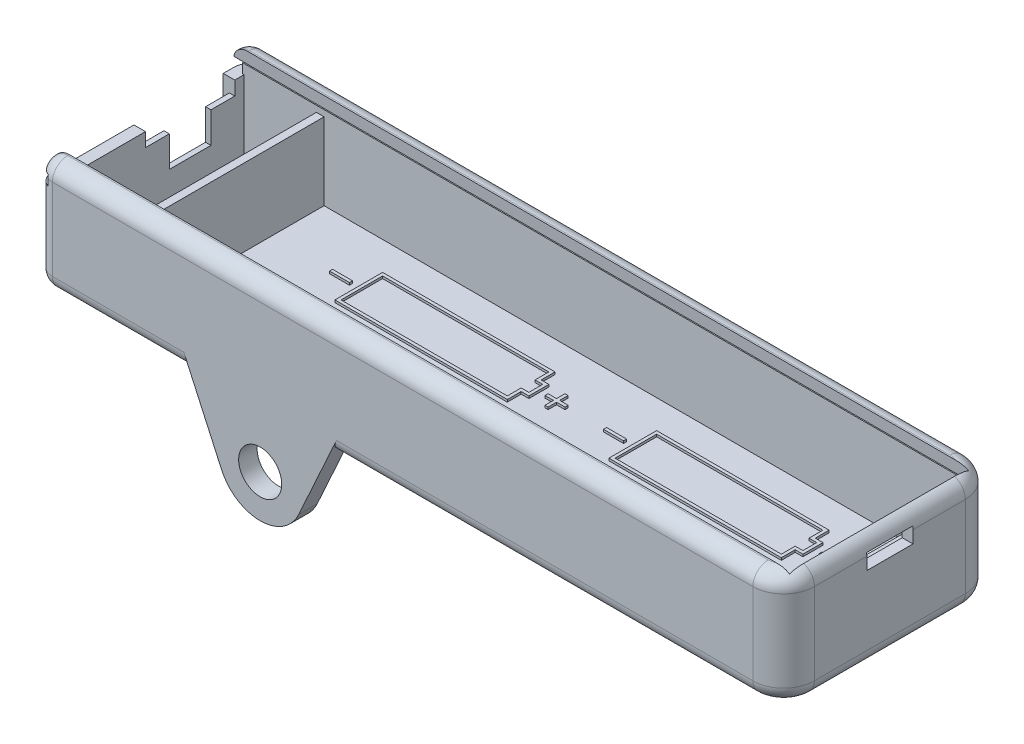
SolidWorks part; units mm, degrees
ref_plane "Front" through (0, 0, 0) normal (0, 0, 1) x (1, 0, 0)
ref_plane "Top" through (0, 0, 0) normal (0, 1, 0) x (1, 0, 0)
ref_plane "Right" through (0, 0, 0) normal (1, 0, 0) x (0, 0, -1)
sketch "Sketch1" plane through (0, 0, 0) normal (0, 1, 0) x (1, 0, 0)
  line L0 (0, 0) -> (123.19, 0)
  line L1 (0, 0) -> (0, 35.052)
  line L2 (123.19, 35.052) -> (0, 35.052)
  line L3 (123.19, 35.052) -> (123.19, 0)
  dimension "Length" = 123.19
  dimension "Width" = 35.052
extrude "Base-Extrude" add sketch "Sketch1" along normal blind 18.542
shell "Shell1" thickness 2.794
sketch "Sketch3" plane through (-30.8976, 18.1349, 0) normal (0, 0, 1) x (1, 0, 0)
  line L1 (30.8976, -18.1349) -> (154.0876, -18.1349) construction
  line L2 (56.2976, -18.1349) -> (79.1576, -18.1349)
  line L3 (30.8976, 0.4071) -> (30.8976, -18.1349) construction
  line L6 (61.3697, -29.2827) -> (56.2976, -18.1349)
  line L7 (74.0854, -29.2827) -> (79.1576, -18.1349)
  line L9 (67.7276, -26.3899) -> (67.7276, -18.7454) construction
  arc A0 (74.0854, -29.2827) -> (61.3697, -29.2827) centre (67.7276, -26.3899) cw
  circle A1 centre (67.7276, -26.3899) radius 3.556
  dimension "D6" = 6.985
  dimension "D3" = 7.112
  dimension "D2" = 25.4
  dimension "D4" = 22.86
  dimension "D1" = 15.24
extrude "Tab" add sketch "Sketch3" against normal blind 3.048
fillet "Fillet1" radius 5.08 2 edges at (123.19, 9.271, 0) (123.19, 9.271, -35.052)
fillet "Fillet2" radius 2.54 3 edges at (0, 9.271, 0) (0, 9.271, -35.052)
sketch "Sketch16" plane through (0, 0, -3.048) normal (0, 0, -1) x (-1, 0, 0)
  point P0 (-36.83, -8.255)
sketch "Sketch17" plane through (0, 0, 0) normal (0, 0, 1) x (1, 0, 0)
  point P0 (36.83, -8.255)
ref_plane "Plane1" through (36.83, 0, 0) normal (-1, 0, 0) x (0, 0, 1)
sketch "Sketch18" plane through (36.83, 0, 0) normal (-1, 0, 0) x (0, 0, 1)
  line L0 (-3.048, -15.24) -> (-3.048, -11.811) construction
  line L3 (-3.048, -11.811) -> (-1.524, -11.811) construction
  line L4 (-1.524, -11.811) -> (-1.524, -15.24) construction
  line L5 (-3.048, -11.811) -> (-3.048, -12.065)
  line L6 (0, -8.255) -> (-3.048, -8.255) construction
  line L7 (-3.048, -12.065) -> (-1.524, -14.986)
  line L8 (-1.524, -14.986) -> (-1.524, -15.24)
  dimension "D1" = 1.524
  dimension "D2" = 0.254
  dimension "D3" = 0.254
surface "Surface1" sketch "Sketch18" parameters "D1"=360
sketch "Sketch4" plane through (0, 0, -3.048) normal (0, 0, -1) x (-1, 0, 0)
  line L0 (-33.274, -8.255) -> (-33.274, -14.2671) construction
  line L1 (-40.386, -8.255) -> (-40.386, -14.2671) construction
  line L2 (-40.132, -14.4102) -> (-40.132, -9.5748)
  line L3 (-33.528, -14.4102) -> (-33.528, -9.5748)
  circle A0 centre (-36.83, -8.255) radius 3.556 construction
  arc A1 (-43.1878, -11.1478) -> (-30.4722, -11.1478) centre (-36.83, -8.255) ccw construction
  arc A2 (-40.132, -9.5748) -> (-33.528, -9.5748) centre (-36.83, -8.255) ccw
  arc A3 (-40.132, -14.4102) -> (-33.528, -14.4102) centre (-36.83, -8.255) ccw
  dimension "D1" = 0.254
  dimension "D2" = 0.254
extrude "Snap bevel" cut sketch "Sketch4" against normal up to surface (1.524 mm away)
ref_plane "Mirror Plane" through (0, 0, -17.526) normal (0, 0, -1) x (-1, 0, 0)
mirror "Mirror8" about plane through (0, 0, -17.526) normal (0, 0, -1) of "Tab"
mirror "Mirror9" about plane through (0, 0, -17.526) normal (0, 0, -1) of "Snap bevel"
fillet "Fillet4" radius 2.54 5 edges at (123.19, 0, -17.526) (83.185, 0, -35.052) (121.7021, 0, -33.5641) (121.7021, 0, -1.4879)
fillet "Fillet6" radius 2.54 5 edges at (0, 0, -17.526) (0.7439, 0, -34.3081) (0.7439, 0, -0.7439) (13.97, 0, -35.052)
sketch "Sketch19" plane through (0.6366, 0, 0.629) normal (0, -1, 0) x (1, 0, 0)
  line L2 (-38.7052, -18.155) -> (37.432, -18.155) construction
  line L3 (-0.6366, -3.169) -> (-0.6366, -33.141) construction
  circle A0 centre (13.9684, -18.155) radius 9.271
  circle A1 centre (13.9684, -18.155) radius 8.001
  dimension "D1" = 18.542
  dimension "D2" = 16.002
  dimension "D4" = 14.605
extrude "Spring retainer" add sketch "Sketch19" along normal blind 1.778
fillet "Fillet8" radius 2.54 9 edges at (1.905, 18.542, -17.526) (123.19, 18.542, -17.526) (60.325, 18.542, -35.052) (121.7021, 18.542, -33.5641) (121.7021, 18.542, -1.4879) (60.325, 18.542, 0) (0, 18.542, -17.526) (0.7439, 18.542, -34.3081) (0.7439, 18.542, -0.7439)
sketch "Sketch20" plane through (1.905, 0, 0) normal (1, 0, 0) x (0, 0, -1)
  line L0 (26.797, 12.6193) -> (30.734, 12.6193)
  line L2 (2.794, 14.9053) -> (16.002, 14.9053)
  line L3 (26.797, 12.6193) -> (26.797, 7.5393)
  line L4 (2.794, 18.4613) -> (2.794, 2.794)
  line L5 (2.794, 2.794) -> (32.258, 2.794)
  line L6 (32.258, 2.794) -> (32.258, 18.4613)
  line L7 (32.258, 18.4613) -> (2.794, 18.4613)
  line L8 (2.794, 18.4613) -> (2.794, 14.9053)
  line L9 (19.939, 7.5393) -> (26.797, 7.5393)
  line L10 (32.258, 14.9053) -> (32.258, 18.4613)
  line L11 (32.258, 18.4613) -> (2.794, 18.4613)
  line L12 (19.939, 7.5393) -> (19.939, 12.6193)
  line L13 (30.734, 14.9053) -> (32.258, 14.9053)
  line L14 (30.734, 14.9053) -> (30.734, 12.6193)
  line L15 (16.002, 12.6193) -> (19.939, 12.6193)
  line L16 (16.002, 12.6193) -> (16.002, 14.9053)
  dimension "D3" = 6.858
  dimension "D4" = 14.732
  dimension "D5" = 5.08
  dimension "D2" = 3.556
  dimension "D6" = 13.208
  dimension "D7" = 1.524
  dimension "D8" = 2.286
  dimension "D1" = 0
extrude "Switch cut-out" cut sketch "Sketch20" against normal through all
sketch "Sketch21" plane through (0, 0, 0) normal (-1, 0, 0) x (0, 0, 1)
  line L0 (-35.052, 16.51) -> (0, 16.51)
  line L1 (-35.052, 16.51) -> (-35.052, 14.9053)
  line L2 (0, 14.9053) -> (-35.052, 14.9053)
  line L3 (0, 14.9053) -> (0, 16.51)
  line L4 (-2.794, 14.9053) -> (-16.002, 14.9053) construction
  line L5 (0, 16.002) -> (0, 2.54) construction
  line L6 (-35.052, 2.54) -> (-35.052, 16.002) construction
  line L7 (-31.0792, 18.542) -> (-3.9728, 18.542) construction
  dimension "D1" = 1.6047
  dimension "D2" = 2.032
extrude "Cut-Extrude3" cut sketch "Sketch21" against normal blind 1.651
sketch "Sketch22" plane through (0, 0, 0) normal (-1, 0, 0) x (0, 0, 1)
  line L0 (-30.734, 12.6193) -> (-16.002, 12.6193)
  line L1 (-30.734, 12.6193) -> (-30.734, 3.7293)
  line L2 (-16.002, 3.7293) -> (-30.734, 3.7293)
  line L3 (-16.002, 3.7293) -> (-16.002, 12.6193)
  line L4 (-16.002, 12.6193) -> (-16.002, 14.9053) construction
  dimension "D1" = 8.89
extrude "On-Off recess" cut sketch "Sketch22" against normal blind 1.016
sketch "Sketch23" plane through (0, 0, -35.052) normal (0, 0, -1) x (-1, 0, 0)
  line L0 (0, 14.9053) -> (0, 2.54) construction
  line L1 (-118.11, 18.542) -> (-2.54, 18.542) construction
  circle A1 centre (-12.065, 6.477) radius 2.8575
  dimension "D2" = 5.715
  dimension "D3" = 12.065
  dimension "D4" = 12.065
extrude "Wire hole" cut sketch "Sketch23" against normal up to next
sketch "Sketch25" plane through (0, 2.794, 0) normal (0, 1, 0) x (-1, 0, 0)
  line L0 (-13.843, -32.258) -> (-13.843, -4.572)
  line L1 (-119.2172, -32.258) -> (-2.54, -32.258) construction
  line L2 (-1.905, -2.794) -> (-1.905, -16.002) construction
  dimension "D1" = 11.938
  dimension "D2" = 27.686
extrude "Battery divider" add sketch "Sketch25" along normal blind 12.7 thin
sketch "Sketch26" plane through (0, 0, -35.052) normal (0, 0, -1) x (-1, 0, 0)
  circle A0 centre (-12.065, 6.477) radius 2.8575 construction
  circle A1 centre (-12.065, 6.477) radius 4.1275
  circle A2 centre (-12.065, 6.477) radius 4.1275
  circle A3 centre (-12.065, 6.477) radius 2.8575
  dimension "D1" = 1.27
extrude "Arm pivot" add sketch "Sketch26" along normal blind 4.318
sketch "Sketch27" plane through (0, 0, -39.37) normal (0, 0, -1) x (-1, 0, 0)
  circle A0 centre (-12.065, 6.477) radius 2.8575 construction
  circle A1 centre (-12.065, 6.477) radius 5.3975
  circle A2 centre (-12.065, 6.477) radius 5.3975
  circle A3 centre (-12.065, 6.477) radius 2.8575
  dimension "D1" = 1.27
extrude "Arm snap collar" add sketch "Sketch27" along normal blind 1.778
chamfer "Chamfer2" distance 1.27 angle 45 1 edges at (6.6675, 6.477, -41.148)
sketch "Sketch28" plane through (0, 0, -41.148) normal (0, 0, -1) x (-1, 0, 0)
  line L0 (-17.425, 7.112) -> (-6.705, 7.112)
  line L2 (-6.705, 5.842) -> (-17.425, 5.842)
  circle A0 centre (-12.065, 6.477) radius 5.3975 construction
  arc A1 (-17.425, 7.112) -> (-17.425, 5.842) centre (-12.065, 6.477) ccw
  arc A2 (-6.705, 5.842) -> (-6.705, 7.112) centre (-12.065, 6.477) ccw
  dimension "D1" = 1.27
extrude "Snap collar relief" cut sketch "Sketch28" against normal offset from surface (4.826 mm away) 1.27
sketch "Sketch29" plane through (0, 0, -35.052) normal (0, 0, -1) x (-1, 0, 0)
  line L0 (-21.4312, 2.54) -> (-2.6988, 2.54)
  line L1 (-24.2443, 2.54) -> (-13.3045, 2.54) construction
  arc A0 (-21.4312, 2.54) -> (-2.6988, 2.54) centre (-12.065, 6.477) ccw
  dimension "D1" = 20.32
extrude "Arm backing plate" add sketch "Sketch29" against normal blind 2.032
sketch "Sketch30" plane through (0, 18.542, 0) normal (0, 1, 0) x (-1, 0, 0)
  line L0 (-120.396, -32.258) -> (-121.412, -32.258)
  line L1 (-120.396, -32.258) -> (-120.396, -2.794)
  line L2 (-121.412, -2.794) -> (-120.396, -2.794)
  line L3 (-121.412, -2.794) -> (-121.412, -32.258)
  line L4 (-2.54, -2.794) -> (-119.2172, -2.794) construction
  line L5 (-123.19, -29.972) -> (-123.19, -5.08) construction
  line L7 (-120.396, -32.258) -> (-120.396, -2.794) construction
  line L8 (-119.2172, -32.258) -> (-2.54, -32.258) construction
  dimension "D1" = 1.778
  dimension "D2" = 1.016
extrude "Cut-Extrude4" cut sketch "Sketch30" against normal blind 5.08
sketch "Sketch31" plane through (121.412, 0, 0) normal (-1, 0, 0) x (0, 0, 1)
  line L0 (-21.336, 13.97) -> (-13.716, 13.97)
  line L1 (-21.336, 13.97) -> (-21.336, 16.51)
  line L2 (-13.716, 16.51) -> (-21.336, 16.51)
  line L3 (-13.716, 16.51) -> (-13.716, 13.97)
  line L7 (-2.794, 18.542) -> (-32.258, 18.542) construction
  line L8 (-2.794, 13.462) -> (-32.258, 13.462) construction
  point P6 (-17.526, 16.51)
  point P8 (-17.526, 13.462)
  dimension "D1" = 2.54
  dimension "D2" = 7.62
  dimension "D3" = 2.032
extrude "Cut-Extrude5" cut sketch "Sketch31" against normal through all
sketch "Sketch33" plane through (0, 0, 0) normal (-1, 0, 0) x (0, 0, 1)
  line L0 (-2.794, 18.542) -> (-2.794, 16.51) construction
  line L1 (-2.794, 18.542) -> (-2.794, 16.51)
  line L2 (-2.794, 16.51) -> (-2.6162, 16.51)
  line L3 (-2.6162, 16.51) -> (-2.794, 18.542)
  dimension "D1" = 2.032
  dimension "D2" = 5
extrude "Cover groove1" cut sketch "Sketch33" against normal up to surface (121.412 mm away)
mirror "Mirror10" about plane through (0, 0, -17.526) normal (0, 0, -1) of "Cover groove1"
sketch "Sketch35" plane through (37.0512, 2.794, -25.1154) normal (0, 1, 0) x (-1, 0, 0)
  line L0 (-23.7818, 2.1284) -> (-25.1788, 2.1284)
  line L1 (-23.7818, 2.1284) -> (-23.7818, 1.6204)
  line L2 (-27.0838, 1.6204) -> (-25.6868, 1.6204)
  line L3 (-27.0838, 1.6204) -> (-27.0838, 2.1284)
  line L4 (-25.1788, 0.2234) -> (-25.6868, 0.2234)
  line L5 (-25.1788, 0.2234) -> (-25.1788, 1.6204)
  line L6 (-25.6868, 3.5254) -> (-25.1788, 3.5254)
  line L7 (-25.6868, 3.5254) -> (-25.6868, 2.1284)
  line L8 (-25.1788, 1.6204) -> (-23.7818, 1.6204)
  line L9 (-25.1788, 2.1284) -> (-25.1788, 3.5254)
  line L10 (-25.6868, 2.1284) -> (-27.0838, 2.1284)
  line L11 (-25.6868, 1.6204) -> (-25.6868, 0.2234)
  line L12 (-82.166, -7.1426) -> (34.5112, -7.1426) construction
  line L13 (11.7782, 2.1284) -> (8.4762, 2.1284)
  line L14 (11.7782, 2.1284) -> (11.7782, 1.6204)
  line L15 (8.4762, 1.6204) -> (11.7782, 1.6204)
  line L16 (8.4762, 1.6204) -> (8.4762, 2.1284)
  line L17 (21.9382, -7.1426) -> (21.9382, 20.5434) construction
  line L18 (7.2062, -2.0626) -> (-21.2418, -2.0626)
  line L19 (7.2062, -2.0626) -> (7.2062, 5.8114)
  line L20 (-21.2418, 5.8114) -> (7.2062, 5.8114)
  line L21 (-21.2418, 5.8114) -> (-21.2418, 3.5254)
  line L22 (-21.2418, 3.5254) -> (-22.5118, 3.5254)
  line L23 (-21.2418, 0.2234) -> (-21.2418, -2.0626)
  line L24 (-22.5118, 0.2234) -> (-21.2418, 0.2234)
  line L25 (-22.5118, 0.2234) -> (-22.5118, 3.5254)
  line L26 (6.6982, 5.3034) -> (-20.7338, 5.3034)
  line L27 (6.6982, 5.3034) -> (6.6982, -1.5546)
  line L28 (-20.7338, -1.5546) -> (6.6982, -1.5546)
  line L29 (-20.7338, -1.5546) -> (-20.7338, 0.7314)
  line L30 (-20.7338, 0.7314) -> (-22.0038, 0.7314)
  line L31 (-20.7338, 3.0174) -> (-20.7338, 5.3034)
  line L32 (-22.0038, 3.0174) -> (-20.7338, 3.0174)
  line L33 (-22.0038, 3.0174) -> (-22.0038, 0.7314)
  dimension "D1" = 7.874
  dimension "thickness" = 0.508
  dimension "D2" = 1.27
  dimension "D3" = 28.448
  dimension "D4" = 1.27
  dimension "D5" = 1.27
  dimension "D6" = 3.302
  dimension "D7" = 3.302
  dimension "D8" = 5.08
  dimension "D9" = 14.732
extrude "Boss-Extrude2" add sketch "Sketch35" along normal blind 0.381
sketch "Sketch36" plane through (46.1641, 2.794, -11.731) normal (0, -1, 0) x (1, 0, 0)
  line L0 (-17.5891, 0.174) -> (-18.9861, 0.174)
  line L1 (-17.5891, 0.174) -> (-17.5891, -0.334)
  line L2 (-20.8911, -0.334) -> (-19.4941, -0.334)
  line L3 (-20.8911, -0.334) -> (-20.8911, 0.174)
  line L4 (-18.9861, -1.731) -> (-19.4941, -1.731)
  line L5 (-18.9861, -1.731) -> (-18.9861, -0.334)
  line L6 (-19.4941, 1.571) -> (-18.9861, 1.571)
  line L7 (-19.4941, 1.571) -> (-19.4941, 0.174)
  line L8 (-18.9861, -0.334) -> (-17.5891, -0.334)
  line L9 (-18.9861, 0.174) -> (-18.9861, 1.571)
  line L10 (-19.4941, 0.174) -> (-20.8911, 0.174)
  line L11 (-19.4941, -0.334) -> (-19.4941, -1.731)
  line L12 (-16.3191, -15.447) -> (-16.3191, -7.573) construction
  line L13 (17.9709, 0.174) -> (14.6689, 0.174)
  line L14 (17.9709, 0.174) -> (17.9709, -0.334)
  line L15 (14.6689, -0.334) -> (17.9709, -0.334)
  line L16 (14.6689, -0.334) -> (14.6689, 0.174)
  line L17 (-43.6241, 8.937) -> (73.0531, 8.937) construction
  line L18 (13.3989, -4.017) -> (-15.0491, -4.017)
  line L19 (13.3989, -4.017) -> (13.3989, 3.857)
  line L20 (-15.0491, 3.857) -> (13.3989, 3.857)
  line L21 (-15.0491, 3.857) -> (-15.0491, 1.571)
  line L22 (-15.0491, 1.571) -> (-16.3191, 1.571)
  line L23 (-15.0491, -1.731) -> (-15.0491, -4.017)
  line L24 (-16.3191, -1.731) -> (-15.0491, -1.731)
  line L25 (-16.3191, -1.731) -> (-16.3191, 1.571)
  line L26 (12.8909, 3.349) -> (-14.5411, 3.349)
  line L27 (12.8909, 3.349) -> (12.8909, -3.509)
  line L28 (-14.5411, -3.509) -> (12.8909, -3.509)
  line L29 (-14.5411, -3.509) -> (-14.5411, -1.223)
  line L30 (-14.5411, -1.223) -> (-15.8111, -1.223)
  line L31 (-14.5411, 1.063) -> (-14.5411, 3.349)
  line L32 (-15.8111, 1.063) -> (-14.5411, 1.063)
  line L33 (-15.8111, 1.063) -> (-15.8111, -1.223)
  dimension "D1" = 7.874
  dimension "thickness" = 0.508
  dimension "D2" = 1.27
  dimension "D3" = 28.448
  dimension "D4" = 1.27
  dimension "D5" = 1.27
  dimension "D6" = 3.302
  dimension "D7" = 3.302
  dimension "D8" = 5.08
extrude "Boss-Extrude3" add sketch "Sketch36" against normal blind 0.381
pattern_linear "LPattern1" count 2 spacing 45.212 along (1, 0, 0) of "Boss-Extrude3", "Boss-Extrude2"
